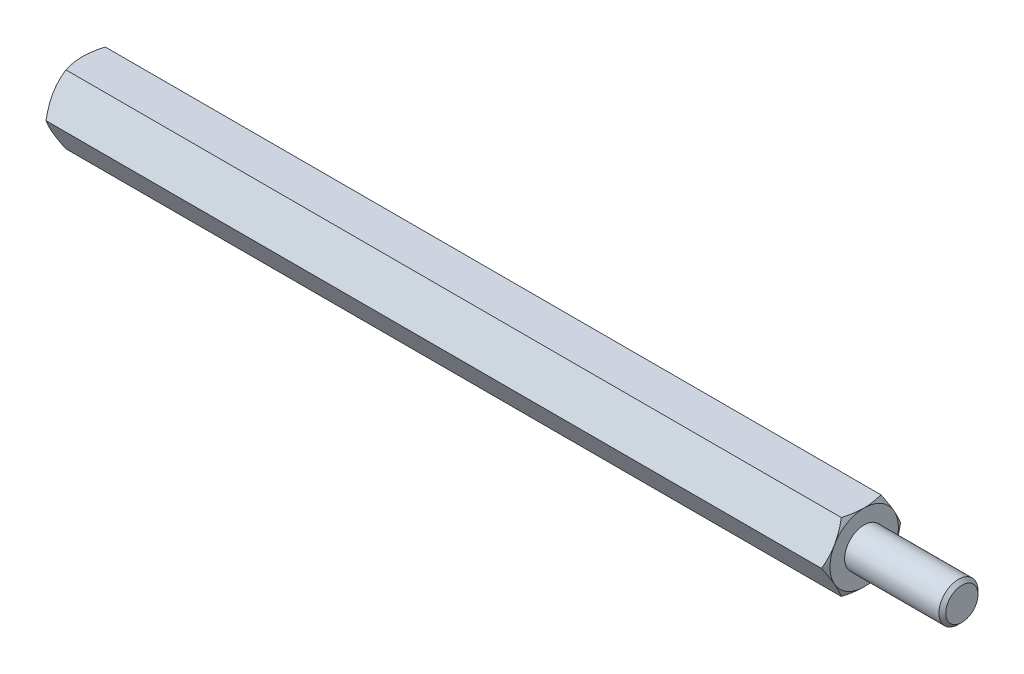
SolidWorks part; units mm, degrees
ref_plane "Front Plane" through (0, 0, 0) normal (0, 0, 1) x (1, 0, 0)
ref_plane "Top Plane" through (0, 0, 0) normal (0, 1, 0) x (1, 0, 0)
ref_plane "Right Plane" through (0, 0, 0) normal (1, 0, 0) x (0, 0, -1)
sketch "Sketch1" plane through (0, 0, 0) normal (1, 0, 0) x (0, 0, -1)
  line L1 (2.0207, 3.5) -> (-2.0207, 3.5)
  line L2 (-2.0207, 3.5) -> (-4.0415, 0)
  line L3 (-4.0415, 0) -> (-2.0207, -3.5)
  line L4 (-2.0207, -3.5) -> (2.0207, -3.5)
  line L5 (2.0207, -3.5) -> (4.0415, 0)
  line L6 (4.0415, 0) -> (2.0207, 3.5)
  circle A0 centre (0, 0) radius 3.5 construction
  dimension "D1" = 7
extrude "Extrude2" add sketch "Sketch1" along normal mid plane 80
sketch "Sketch2" plane through (0, 0, 0) normal (0, 0, 1) x (1, 0, 0)
  line L0 (-40, 3.5) -> (-38.5, 6.0981)
  line L1 (-40, 6.5) -> (-40, 3.5)
  line L3 (0, 0) -> (50000, 0) construction
  arc A0 (-38.5, 6.0981) -> (-40, 6.5) centre (-39.1962, 6.5) ccw
  dimension "D1" = 30
  dimension "D2" = 3
revolve "Cut-Revolve1" cut sketch "Sketch2" angle 360 about L3
mirror "Mirror1" about plane through (0, 0, 0) normal (1, 0, 0) of "Cut-Revolve1"
sketch "Sketch3" plane through (-40, 0, 0) normal (-1, 0, 0) x (0, 0, 1)
  circle A0 centre (0, 0) radius 1.65
  dimension "D1" = 3.3
extrude "Extrude3" cut sketch "Sketch3" against normal blind 10
sketch "Sketch4" plane through (0, 0, 0) normal (0, 0, 1) x (1, 0, 0)
  line L0 (-30, 0) -> (-30, 1.65)
  line L1 (39.6874, 0) -> (-39.6874, 0) construction
  line L2 (-30, 1.65) -> (-29.0474, 0)
  line L3 (-29.0474, 0) -> (-30, 0)
  line L4 (-40, 1.75) -> (-40, -1.75) construction
  point P4 (-40, 0)
  dimension "D1" = 30
  dimension "D2" = 1.65
  dimension "D3" = 10
revolve "Cut-Revolve2" cut sketch "Sketch4" angle 360 about L3
sketch "Sketch5" plane through (40, 0, 0) normal (1, 0, 0) x (0, 0, -1)
  circle A0 centre (0, 0) radius 2
  dimension "D1" = 4
extrude "Extrude4" add sketch "Sketch5" along normal blind 10
chamfer "Chamfer1" distance 0.35 angle 45 1 edges at (50, 0, -2)
equation "\"D2@Sketch4\" = \"D1@Sketch3\"/2"
